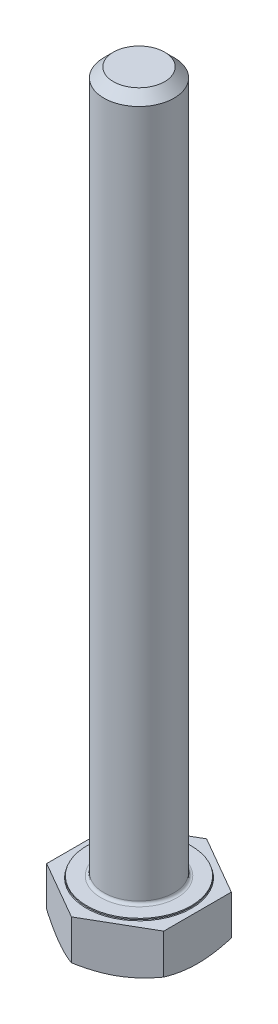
SolidWorks part; units mm, degrees
ref_plane "Plan de face" through (0, 0, 0) normal (0, 0, 1) x (1, 0, 0)
ref_plane "Plan de dessus" through (0, 0, 0) normal (0, 1, 0) x (1, 0, 0)
ref_plane "Plan de droite" through (0, 0, 0) normal (1, 0, 0) x (0, 0, -1)
imported_body "Importée3"
sketch "Esquisse1" plane through (0, -3.5534, 0) normal (0, 1, 0) x (-1, 0, 0)
  line L0 (5, 2.8868) -> (5, -2.8868)
  line L1 (5, -2.8868) -> (0, -5.7735)
  line L2 (0, -5.7735) -> (-5, -2.8868)
  line L3 (-5, -2.8868) -> (-5, 2.8868)
  line L4 (-5, 2.8868) -> (0, 5.7735)
  line L5 (0, 5.7735) -> (5, 2.8868)
extrude "Boss.-Extru.1" add sketch "Esquisse1" along normal blind 3.4034
sketch "Esquisse2" plane through (0, 0, 0) normal (0, 0, 1) x (1, 0, 0)
  line L0 (3, 59.85) -> (0, 59.85)
  line L1 (0, 59.85) -> (0, -0.15)
  line L2 (0, -0.15) -> (4.45, -0.15)
  line L3 (4.45, -0.15) -> (4.45, 0)
  line L4 (4.45, 0) -> (3, 0)
  line L5 (3, 0) -> (3, 59.85)
  line L6 (0, 59.85) -> (0, -0.15) construction
  dimension "D1" = 3
  dimension "D2" = 0.15
  dimension "D3" = 4.45
  dimension "D4" = 60
revolve "Révolution1" add sketch "Esquisse2" angle 360 about L6
chamfer "Chanfrein1" distance 0.8119 angle 45 1 edges at (3, 59.85, 0)
chamfer "Chanfrein2" distance 0.05 angle 45 1 edges at (4.45, -0.15, 0)
fillet "Congé1" radius 0.25 1 edges at (3, 0, 0)
